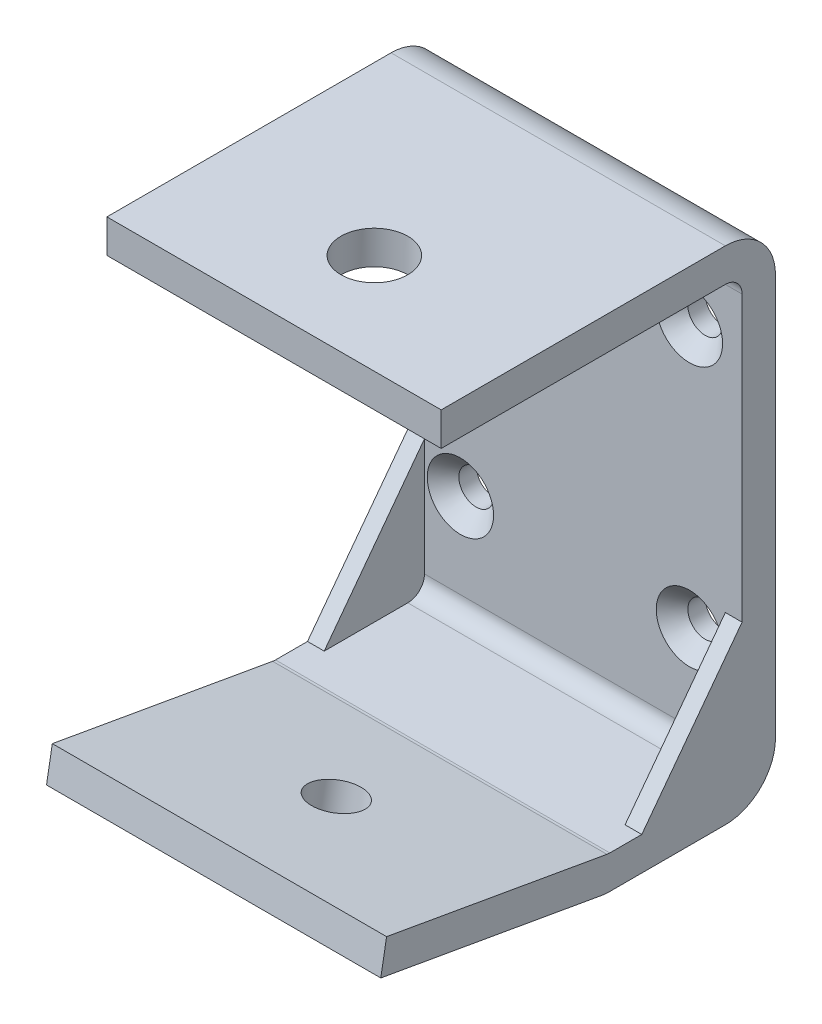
SolidWorks part; units mm, degrees
ref_plane "front" through (0, 0, 0) normal (0, 0, 1) x (1, 0, 0)
ref_plane "top" through (0, 0, 0) normal (0, 1, 0) x (1, 0, 0)
ref_plane "right" through (0, 0, 0) normal (1, 0, 0) x (0, 0, -1)
sketch "Sketch1" plane through (0, 0, 0) normal (1, 0, 0) x (0, 0, -1)
  line L0 (0, 0) -> (0, 82.55)
  line L1 (0, 82.55) -> (-57.15, 82.55)
  line L4 (-67.5238, 7.4276) -> (-25.4, 0)
  line L5 (-25.4, 0) -> (0, 0)
  dimension "D1" = 82.55
  dimension "D2" = 57.15
  dimension "D3" = 10
  dimension "D4" = 42.7736
  dimension "D5" = 25.4
extrude "Base-Extrude-Thin" add sketch "Sketch1" along normal mid plane 63.5 thin
sketch "Sketch2" plane through (0, 88.9, 0) normal (0, 1, 0) x (-1, 0, 0)
  line L0 (0, 50) -> (0, -50) construction
  line L1 (-31.75, 57.15) -> (31.75, 57.15) construction
  circle A0 centre (0, 38.1) radius 6.35
  dimension "D1" = 12.7
  dimension "D2" = 19.05
extrude "Cut-Extrude1" cut sketch "Sketch2" against normal up to next
sketch "Sketch3" plane through (31.75, 0, 0) normal (1, 0, 0) x (0, 0, -1)
  line L0 (-25.1222, 0) -> (-3.175, 0) construction
  line L1 (0, 3.175) -> (0, 79.375) construction
  line L2 (-19.05, 0) -> (-3.175, 0)
  line L3 (0, 3.175) -> (0, 25.4)
  line L4 (-19.05, 0) -> (0, 25.4)
  arc A0 (-3.175, 0) -> (0, 3.175) centre (-3.175, 3.175) ccw construction
  arc A1 (-3.175, 0) -> (0, 3.175) centre (-3.175, 3.175) ccw
  dimension "D1" = 25.4
  dimension "D2" = 19.05
extrude "Boss-Extrude1" add sketch "Sketch3" against normal blind 3.175
mirror "Mirror1" about plane through (0, 0, 0) normal (1, 0, 0) of "Boss-Extrude1"
sketch "Sketch5" plane through (0, -10.5972, 1.8686) normal (0, -0.9848, 0.1736) x (1, 0, 0)
  circle A0 centre (0, 45.2398) radius 4.7625
extrude "Cut-Extrude2" cut sketch "Sketch5" against normal up to surface (6.35 mm away)
hole_wizard "CSK for M6 Oval Head Machine Screw1" positions "Sketch6" profile "Sketch7" countersink size "M6" standard "Ansi Metric"
sketch "Sketch6" plane through (0, 0, 0) normal (0, 0, 1) x (1, 0, 0)
  point P0 (-21.75, 69.375)
  point P1 (21.75, 69.375)
  point P2 (21.75, 19.375)
  point P3 (-21.75, 19.375)
sketch "Sketch7" plane through (-21.75, 69.375, 0) normal (1, 0, 0) x (0, -1, 0)
  line L0 (0, 0) -> (0, 6.35)
  line L1 (0, 6.35) -> (3.3, 6.35)
  line L2 (3.3, 6.35) -> (3.3, 3)
  line L3 (3.3, 3) -> (6.3, 0)
  line L4 (6.3, 0) -> (0, 0)
  line L5 (-3.3, 3) -> (-6.3, 0) construction
  line L6 (0, -6.35) -> (0, 107.95) construction
  dimension "Thru Hole Dia." = 6.6
  dimension "Thru Hole Depth" = 6.35
  dimension "Near C'Sink Dia." = 12.6
  dimension "Near C'Sink Angle" = 90
